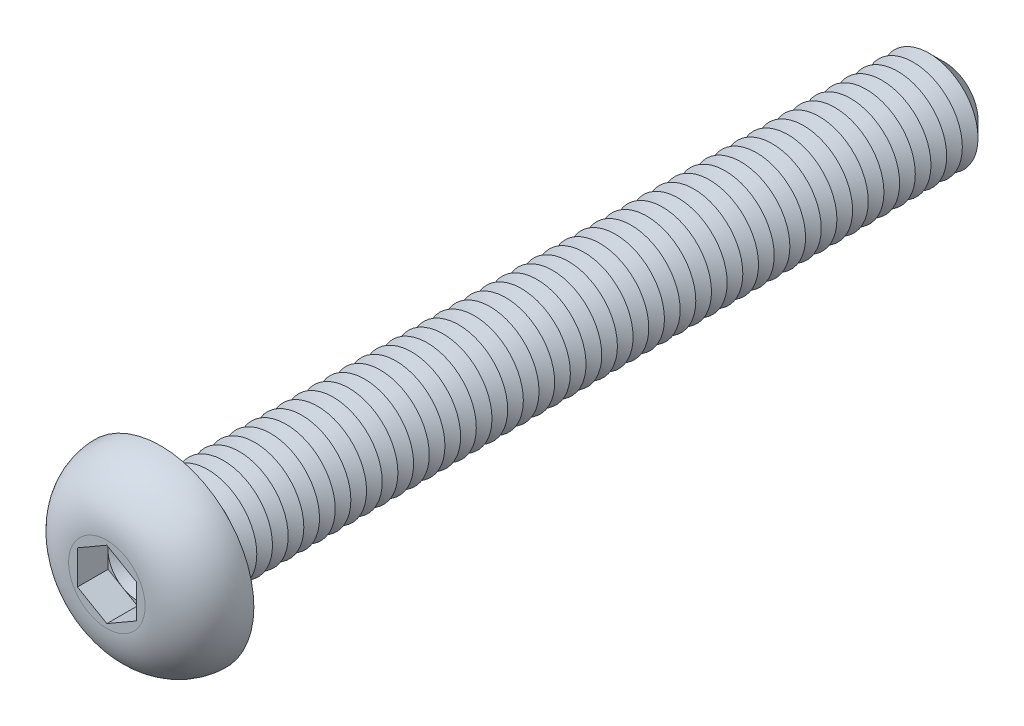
SolidWorks part; units mm, degrees
ref_plane "Front Plane" through (0, 0, 0) normal (0, 0, 1) x (1, 0, 0)
ref_plane "Top Plane" through (0, 0, 0) normal (0, 1, 0) x (1, 0, 0)
ref_plane "Right Plane" through (0, 0, 0) normal (1, 0, 0) x (0, 0, -1)
sketch "Sketch1" plane through (0, 0, 0) normal (1, 0, 0) x (0, 0, -1)
  line L0 (-47.9342, 0) -> (60.3146, 0) construction
sketch "Sketch2" plane through (0, 0, 0) normal (1, 0, 0) x (0, 0, -1)
  line L0 (0, 0) -> (-2.75, 0)
  line L1 (-47.9342, 0) -> (60.3146, 0) construction
  line L2 (-2.75, 0) -> (-2.75, 1.9504)
  line L3 (0, 4.75) -> (0, 0)
  arc A0 (-2.75, 1.9504) -> (0, 4.75) centre (0.05, 1.9504) cw
  dimension "D1" = 2.8
  dimension "D2" = 2.75
  dimension "D3" = 4.75
revolve "Revolve1" add sketch "Sketch2" angle 360 about L0
sketch "Sketch3" plane through (0, 0, 2.75) normal (0, 0, 1) x (1, 0, 0)
  line L1 (0, 1.7321) -> (-1.5, 0.866)
  line L2 (-1.5, 0.866) -> (-1.5, -0.866)
  line L3 (-1.5, -0.866) -> (0, -1.7321)
  line L4 (0, -1.7321) -> (1.5, -0.866)
  line L5 (1.5, -0.866) -> (1.5, 0.866)
  line L6 (1.5, 0.866) -> (0, 1.7321)
  circle A0 centre (0, 0) radius 1.5 construction
  dimension "D1" = 3
extrude "Cut-Extrude1" cut sketch "Sketch3" against normal blind 1.56
sketch "Sketch4" plane through (0, 0, 0) normal (0, 0, -1) x (-1, 0, 0)
  circle A0 centre (0, 0) radius 2.5
  dimension "D1" = 5
extrude "Boss-Extrude1" add sketch "Sketch4" along normal blind 40
chamfer "Chamfer1" distance 0.8 angle 45 1 edges at (-2.5, 0, -40)
sketch "Sketch5" plane through (0, 0, 0) normal (1, 0, 0) x (0, 0, -1)
  line L0 (0.8, 2.5) -> (1.6, 2.5)
  line L1 (39.2, 2.5) -> (0, 2.5) construction
  line L2 (1.6, 2.5) -> (1.2, 1.8072)
  line L3 (1.2, 1.8072) -> (0.8, 2.5)
  line L4 (0, -4.75) -> (0, 4.75) construction
  line L5 (39.2, 2.5) -> (0, 2.5) construction
  dimension "D1" = 0.8
  dimension "D2" = 0.8
revolve "Cut-Revolve1" cut sketch "Sketch5" angle 360 about L0
pattern_linear "LPattern1" count 48 spacing 0.8 along (0, 0, -1) of "Cut-Revolve1"
fillet "Fillet2" radius 0.4 1 edges at (2.5, 0, 0)
sketch "Sketch6" plane through (0, 0, 1.19) normal (0, 0, 1) x (1, 0, 0)
  line L0 (0, -1.7321) -> (1.5, -0.866) construction
  circle A0 centre (0, 0) radius 1.5
extrude "Cut-Extrude2" cut sketch "Sketch6" against normal through all draft 60
